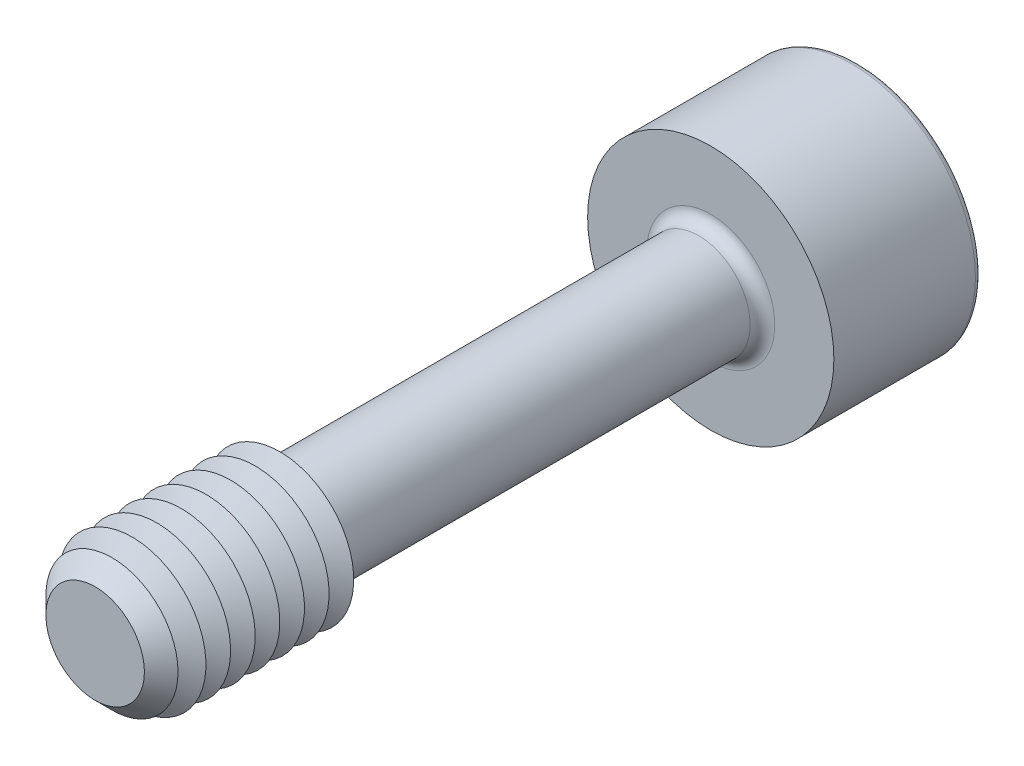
SolidWorks part; units mm, degrees
ref_plane "Front Plane" through (0, 0, 0) normal (0, 0, 1) x (1, 0, 0)
ref_plane "Top Plane" through (0, 0, 0) normal (0, 1, 0) x (1, 0, 0)
ref_plane "Right Plane" through (0, 0, 0) normal (1, 0, 0) x (0, 0, -1)
sketch "Sketch1" plane through (0, 0, 0) normal (0, 0, 1) x (1, 0, 0)
  circle A0 centre (0, 0) radius 2.1
  dimension "D1" = 4.2
extrude "Extrude1" add sketch "Sketch1" along normal mid plane 25
sketch "Sketch2" plane through (0, 0, 0) normal (1, 0, 0) x (0, 0, -1)
  line L0 (-12.5, 0) -> (-12.5, 3)
  line L1 (-12.5, 2.1) -> (-12.5, -2.1) construction
  line L2 (-12.5, 3) -> (-5, 3)
  line L3 (-5, 3) -> (-4.4804, 2.1)
  line L4 (12.5, 2.1) -> (-12.5, 2.1) construction
  line L5 (-4.4804, 2.1) -> (-4.4804, 0)
  line L6 (-4.4804, 0) -> (-12.5, 0)
  dimension "D1" = 3
  dimension "D2" = 120
  dimension "D3" = 7.5
revolve "Revolve1" add sketch "Sketch2" angle 360 about L6
chamfer "Chamfer1" distance 1 angle 45 1 edges at (0, 3, 12.5)
sketch "Sketch3" plane through (0, 0, -12.5) normal (0, 0, -1) x (-1, 0, 0)
  circle A0 centre (0, 0) radius 5
  dimension "D1" = 10
extrude "Extrude2" add sketch "Sketch3" along normal blind 6
sketch "Sketch4" plane through (-13.7, 0, -18.5) normal (0, 0, 1) x (1, 0, 0)
  line L2 (12.2566, -2.5) -> (15.1434, -2.5)
  line L3 (15.1434, -2.5) -> (16.5868, 0)
  line L4 (16.5868, 0) -> (15.1434, 2.5)
  line L6 (15.1434, 2.5) -> (12.2566, 2.5)
  line L7 (12.2566, 2.5) -> (10.8132, 0)
  line L8 (10.8132, 0) -> (12.2566, -2.5)
  circle A0 centre (13.7, 0) radius 2.5 construction
  dimension "D1" = 5
extrude "Extrude3" cut sketch "Sketch4" along normal blind 5
fillet "Fillet1" radius 0.5 1 edges at (-2.1, 0, -12.5)
fillet "Fillet2" radius 0.25 1 edges at (-5, 0, -18.5)
sketch "Sketch5" plane through (0, 0, 0) normal (1, 0, 0) x (0, 0, -1)
  line L0 (13.5, 0) -> (13.5, -2.5)
  line L1 (13.5, -2.5) -> (12.0566, 0)
  line L2 (12.0566, 0) -> (13.5, 0)
  dimension "D1" = 30
revolve "Cut-Revolve1" cut sketch "Sketch5" angle 360 about L2
sketch "Sketch6" plane through (0, 0, 0) normal (1, 0, 0) x (0, 0, -1)
  line L0 (1.332, 0) -> (-13.289, 0) construction
sketch "Sketch7" plane through (0, 0, 0) normal (1, 0, 0) x (0, 0, -1)
  line L0 (-5, 3) -> (-5.5, 2.134)
  line L1 (-5.5, 2.134) -> (-6, 3)
  line L2 (-5, 3) -> (-11.5, 3) construction
  line L3 (-6, 3) -> (-5, 3)
  dimension "D1" = 1
revolve "Cut-Revolve2" cut sketch "Sketch7" angle 360 about L0
pattern_linear "LPattern1" count 7 spacing 1 along (0, 0, 1) of "Cut-Revolve2"
